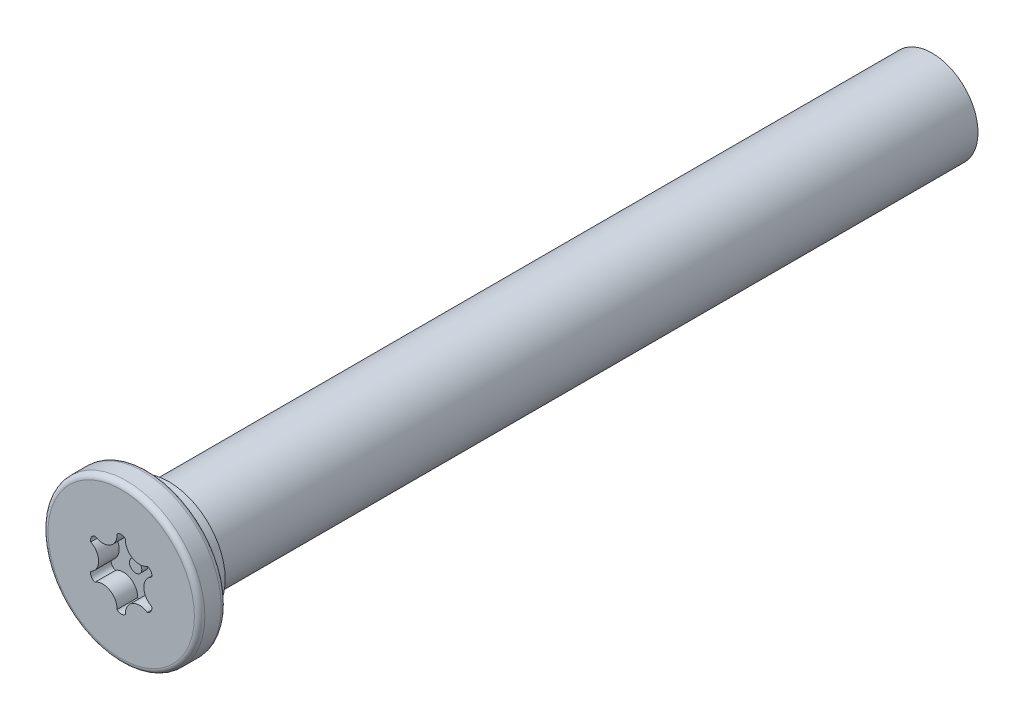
SolidWorks part; units mm, degrees
ref_plane "Front Plane" through (0, 0, 0) normal (0, 0, 1) x (1, 0, 0)
ref_plane "Top Plane" through (0, 0, 0) normal (0, 1, 0) x (1, 0, 0)
ref_plane "Right Plane" through (0, 0, 0) normal (1, 0, 0) x (0, 0, -1)
sketch "Sketch2" plane through (0, 0, 0) normal (1, 0, 0) x (0, 0, -1)
  line L1 (0, 0) -> (1.3, 0)
  line L2 (0, 0) -> (0, 3.81)
  line L3 (0, 3.81) -> (1.3, 3.81)
  line L4 (1.3, 0) -> (1.3, 3.81)
  line L5 (1.3, 0) -> (14, 0)
  line L6 (1.3, 0) -> (1.3, 2.23)
  line L7 (1.3, 2.23) -> (14, 2.23)
  line L8 (14, 0) -> (14, 2.23)
  dimension "D1" = 3.81
  dimension "D2" = 1.3
  dimension "D3" = 12.7
  dimension "D4" = 2.23
revolve "Revolve1" add sketch "Sketch2" angle 360 about L5
sketch "Sketch3" plane through (0, 0, 0) normal (0, 0, 1) x (1, 0, 0)
  line L0 (0, 1.3843) -> (0, 0)
  line L3 (1.1845, -1.0048) -> (2.4257, -1.0048)
  line L4 (0, 1.675) -> (0, 1.6727)
  line L5 (0, 1.675) -> (0, 1.6727)
  line L6 (0, 1.6727) -> (0, 1.675)
  line L8 (1.0407, 1.8026) -> (1.1012, 1.9073)
  line L9 (1.3857, 1.205) -> (2.5818, 1.205)
  line L10 (0, 0) -> (0.8375, 1.4506)
  line L11 (0, 0) -> (2.5818, 0)
  line L14 (2.5818, 0) -> (2.5818, 1.205)
  line L15 (1.3857, 1.205) -> (-0.1691, 1.205)
  circle A0 centre (0, 0) radius 1.675
  arc A7 (1.1845, -1.0048) -> (1.0345, -1.0748) centre (0.8546, -0.4934) cw
  arc A16 (-0.2051, 1.5894) -> (0.2051, 1.5894) centre (0, 1.3843) cw
  arc A18 (0.2051, 1.5894) -> (1.2739, 0.9723) centre (0.8938, 1.5482) ccw
  arc A19 (1.479, 0.6171) -> (1.479, -0.6171) centre (1.7877, 0) ccw
  arc A20 (1.2739, 0.9723) -> (1.479, 0.6171) centre (1.1988, 0.6922) cw
  arc A21 (1.2739, -0.9723) -> (0.2051, -1.5894) centre (0.8938, -1.5482) ccw
  arc A22 (1.479, -0.6171) -> (1.2739, -0.9723) centre (1.1988, -0.6922) cw
  arc A23 (-0.2051, -1.5894) -> (-1.2739, -0.9723) centre (-0.8938, -1.5482) ccw
  arc A24 (0.2051, -1.5894) -> (-0.2051, -1.5894) centre (0, -1.3843) cw
  arc A25 (-1.479, -0.6171) -> (-1.479, 0.6171) centre (-1.7877, 0) ccw
  arc A26 (-1.2739, -0.9723) -> (-1.479, -0.6171) centre (-1.1988, -0.6922) cw
  arc A27 (-1.2739, 0.9723) -> (-0.2051, 1.5894) centre (-0.8938, 1.5482) ccw
  arc A28 (-1.479, 0.6171) -> (-1.2739, 0.9723) centre (-1.1988, 0.6922) cw
  point P38 (0, 0)
  point P52 (0, 0)
  dimension "D1" = 3.35
  dimension "D4" = 1.205
  dimension "D2" = 6
  dimension "D5" = 60
extrude "Cut-Extrude3" cut sketch "Sketch3" against normal blind 1
fillet "Fillet12" radius 0.254 2 edges at (3.81, 0, 0) (3.81, 0, -1.3)
sketch "Sketch7" plane through (0, 0, -14) normal (0, 0, -1) x (-1, 0, 0)
  circle A0 centre (0, 0) radius 2.23
  dimension "D1" = 4.46
extrude "Cut-Extrude6" cut sketch "Sketch7" against normal blind 12.7
sketch "Sketch11" plane through (0, 0, -1.3) normal (0, 0, -1) x (-1, 0, 0)
  circle A0 centre (0, 0) radius 2.23
  circle A1 centre (0, 0) radius 2.738
extrude "Boss-Extrude1" add sketch "Sketch11" along normal blind 1.016
sketch "Sketch12" plane through (0, 0, -1.3) normal (0, 0, -1) x (-1, 0, 0)
  circle A0 centre (0, 0) radius 2.23
extrude "Boss-Extrude2" add sketch "Sketch12" along normal blind 12.7
sketch "Sketch14" plane through (0, 0, -1) normal (0, 0, 1) x (1, 0, 0)
  circle A0 centre (0, 0) radius 0.3
extrude "Boss-Extrude4" add sketch "Sketch14" along normal blind 0.3
sketch "Sketch15" plane through (0, 0, -14) normal (0, 0, -1) x (-1, 0, 0)
  circle A0 centre (0, 0) radius 2.23
extrude "Cut-Extrude7" cut sketch "Sketch15" against normal blind 12.7
sketch "Sketch16" plane through (0, 0, -1.3) normal (0, 0, -1) x (-1, 0, 0)
  circle A0 centre (0, 0) radius 2.23
extrude "Boss-Extrude5" add sketch "Sketch16" along normal blind 38.1 contours A0
